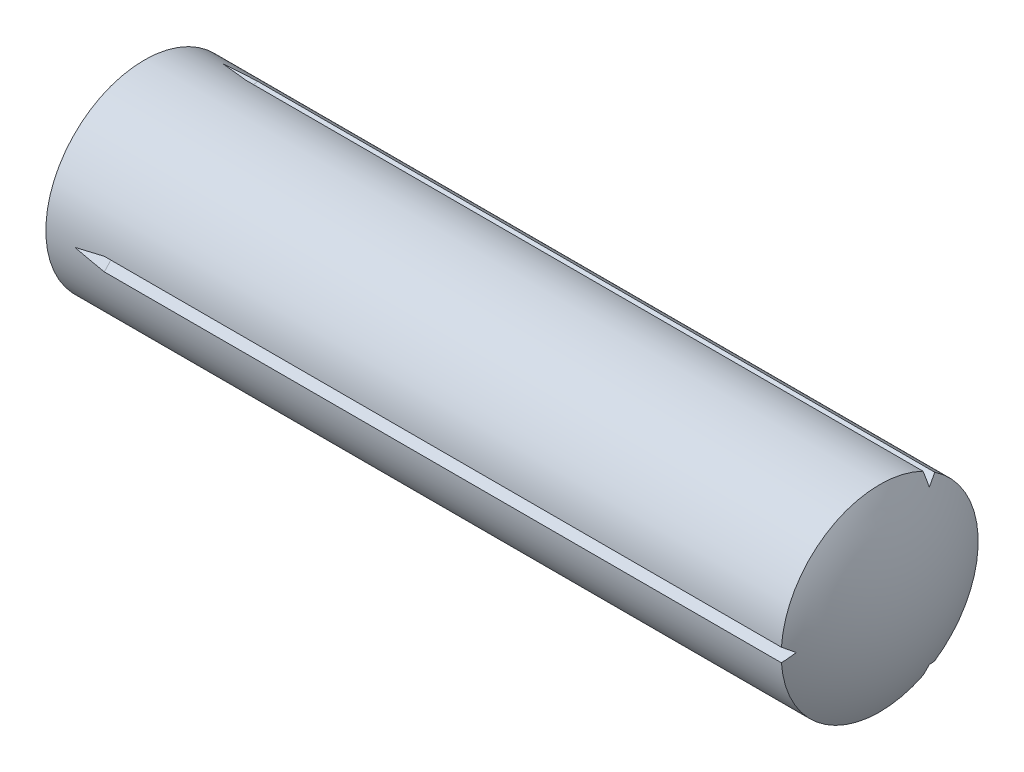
SolidWorks part; units mm, degrees
ref_plane "Plane1" through (0, 0, 0) normal (0, 0, 1) x (1, 0, 0)
ref_plane "Plane2" through (0, 0, 0) normal (0, 1, 0) x (1, 0, 0)
ref_plane "Plane3" through (0, 0, 0) normal (1, 0, 0) x (0, 0, -1)
sketch "Sketch1" plane through (0, 0, 0) normal (0, 0, 1) x (1, 0, 0)
  line L0 (-117, 0) -> (21, 0) construction
  line L1 (-100, 0) -> (-100, 1.25)
  line L2 (-96.6819, 12.5) -> (-3.3494, 12.5)
  line L3 (-100, 0) -> (0, 0)
  arc A0 (-96.6819, 12.5) -> (-100, 1.25) centre (-75.0313, 0) ccw
  arc A1 (0, 0) -> (-3.3494, 12.5) centre (-25, 0) ccw
  dimension "D1" = 25
  dimension "D2" = 25
  dimension "Diameter" = 25
  dimension "D3" = 2.5
  dimension "Length" = 100
revolve "Base-Revolve" add sketch "Sketch1" angle 360 about L0
sketch "Sketch2" plane through (0, 0, 0) normal (1, 0, 0) x (0, 0, -1)
  line L0 (0, 0) -> (-14, 0) construction
  line L1 (-11.25, 0) -> (-12.5, 0.8753)
  line L2 (-11.25, 0) -> (-12.5, -0.8753)
  line L3 (-12.5, -0.8753) -> (-12.5, 0.8753)
  circle A0 centre (0, 0) radius 11.25 construction
  circle A1 centre (0, 0) radius 12.5 construction
  dimension "D1" = 22.5
  dimension "D2" = 70
  dimension "D3" = 35
sketch "Sketch4" plane through (0, 0, 0) normal (0, 1, 0) x (1, 0, 0)
  line L0 (8, 0) -> (-110, 0) construction
  line L1 (-117, 0) -> (21, 0) construction
  line L2 (0, -11.25) -> (-89.5, -11.25)
  line L3 (-89.5, -11.25) -> (-93, -12.5)
  point P7 (-100, 0)
  dimension "D1" = 22.5
  dimension "D2" = 10.5
  dimension "D3" = 100
  dimension "Pilot" = 7
  dimension "D5" = 25
sweep "Cut-Sweep1" cut profiles "Sketch2" path "Sketch4"
pattern_circular "CirPattern1" count 3 over 360 about axis through (0, 0, 0) along (1, 0, 0) of "Cut-Sweep1"
equation "\"D1@Sketch1\" = \"Diameter@Sketch1\""
equation "\"D2@Sketch1\" = \"Diameter@Sketch1\""
equation "\"D1@Sketch2\" = \"Diameter@Sketch1\" * .9"
equation "\"D3@Sketch2\" = \"D2@Sketch2\" / 2"
equation "\"D1@Sketch4\" = \"D1@Sketch2\""
equation "\"D3@Sketch4\" = \"Length@SKetch1\""
equation "\"D5@Sketch4\" = \"Diameter@Sketch1\""
equation "\"D2@Sketch4\" = \"Pilot@Sketch4\" * 1.5"
equation "\"D3@Sketch1\" = \"Diameter@Sketch1\" * .1"
